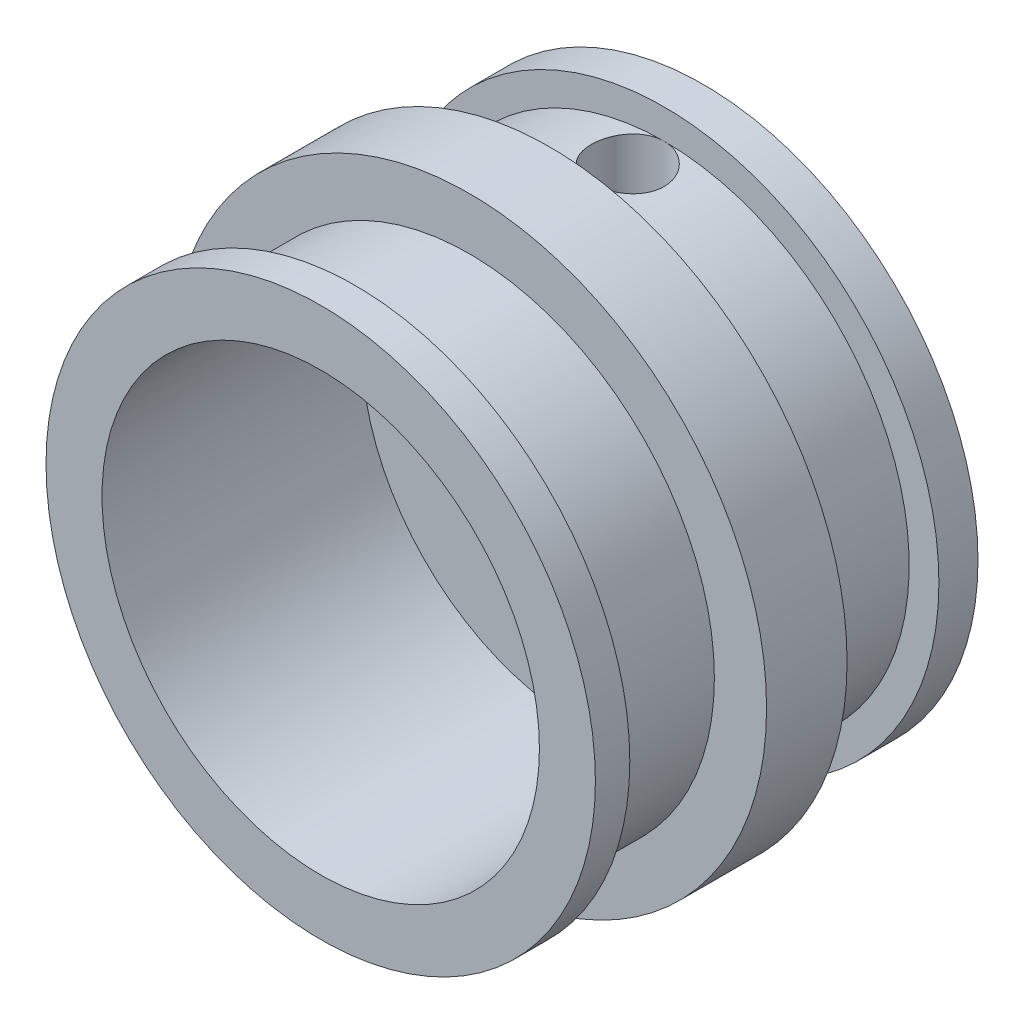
SolidWorks part; units mm, degrees
ref_plane "Płaszczyzna przednia" through (0, 0, 0) normal (0, 0, 1) x (1, 0, 0)
ref_plane "Płaszczyzna górna" through (0, 0, 0) normal (0, 1, 0) x (1, 0, 0)
ref_plane "Płaszczyzna prawa" through (0, 0, 0) normal (1, 0, 0) x (0, 0, -1)
sketch "Szkic1" plane through (0, 0, 0) normal (0, 0, 1) x (1, 0, 0)
  circle A0 centre (0, 0) radius 9.42
  dimension "D1" = 18.84
extrude "Dodanie-wyciągnięcie1" add sketch "Szkic1" along normal blind 1.34
sketch "Szkic2" plane through (0, 0, 1.34) normal (0, 0, 1) x (1, 0, 0)
  circle A0 centre (0, 0) radius 8.4
extrude "Dodanie-wyciągnięcie2" add sketch "Szkic2" along normal blind 3.92
sketch "Szkic3" plane through (0, 0, 5.26) normal (0, 0, 1) x (1, 0, 0)
  circle A0 centre (0, 0) radius 10.19
extrude "Dodanie-wyciągnięcie3" add sketch "Szkic3" along normal blind 2.76
sketch "Szkic4" plane through (0, 0, 8.02) normal (0, 0, 1) x (1, 0, 0)
  circle A0 centre (0, 0) radius 8.4
extrude "Dodanie-wyciągnięcie4" add sketch "Szkic4" along normal blind 3.92
sketch "Szkic5" plane through (0, 0, 11.94) normal (0, 0, 1) x (1, 0, 0)
  circle A0 centre (0, 0) radius 9.42
extrude "Dodanie-wyciągnięcie5" add sketch "Szkic5" along normal blind 1.18
sketch "Szkic6" plane through (0, 0, 13.12) normal (0, 0, 1) x (1, 0, 0)
  circle A0 centre (0, 0) radius 7.5
extrude "Wytnij-wyciągnięcie1" cut sketch "Szkic6" against normal blind 8.9
sketch "Szkic7" plane through (0, 0, 0) normal (0, 0, -1) x (-1, 0, 0)
  circle A0 centre (0, 0) radius 1.5
extrude "Wytnij-wyciągnięcie2" cut sketch "Szkic7" against normal up to next
sketch "Szkic8" plane through (0, 0, 0) normal (0, 1, 0) x (1, 0, 0)
  line L0 (-9.42, -1.34) -> (-8.4, -1.34)
  line L1 (8.4, -1.34) -> (9.42, -1.34)
  line L2 (8.4, -1.34) -> (9.42, -1.34)
  line L3 (-9.42, -1.34) -> (-8.4, -1.34)
  line L4 (-8.4, -1.34) -> (8.4, -1.34) construction
  circle A0 centre (0, -2.59) radius 1.25
extrude "Wytnij-wyciągnięcie3" cut sketch "Szkic8" against normal through all both and the other way through all contours A0
